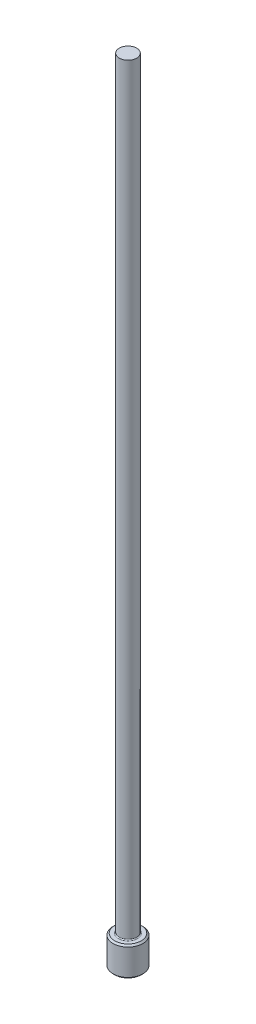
SolidWorks part; units mm, degrees
ref_plane "Front Plane" through (0, 0, 0) normal (0, 0, 1) x (1, 0, 0)
ref_plane "Top Plane" through (0, 0, 0) normal (0, 1, 0) x (1, 0, 0)
ref_plane "Right Plane" through (0, 0, 0) normal (1, 0, 0) x (0, 0, -1)
other "Configuration Table"
sketch "Sketch1" plane through (0, 0, 0) normal (0, 0, 1) x (1, 0, 0)
  line L0 (0, 259.9588) -> (0, -15.1925) construction
  line L1 (0, 0) -> (-1.1938, 0)
  line L2 (-1.1938, 0) -> (-1.1938, 2.3622)
  line L3 (-1.1938, 2.3622) -> (-0.6985, 2.3622)
  line L4 (-0.6985, 2.3622) -> (-0.6985, 63.5)
  line L5 (-0.6985, 63.5) -> (0, 63.5)
  line L6 (0, 63.5) -> (0, 0)
  dimension "L" = 63.5
  dimension "H" = 2.3876
  dimension "T" = 2.3622
  dimension "D" = 1.397
revolve "Revolve1" add sketch "Sketch1" angle 360 about L0
chamfer "Chamfer1" distance 0.127 angle 45 2 edges at (0, 2.3622, 1.1938) (0, 0, 1.1938)
fillet "Fillet1" radius 0.0762 1 edges at (0, 2.3622, 0.6985)
